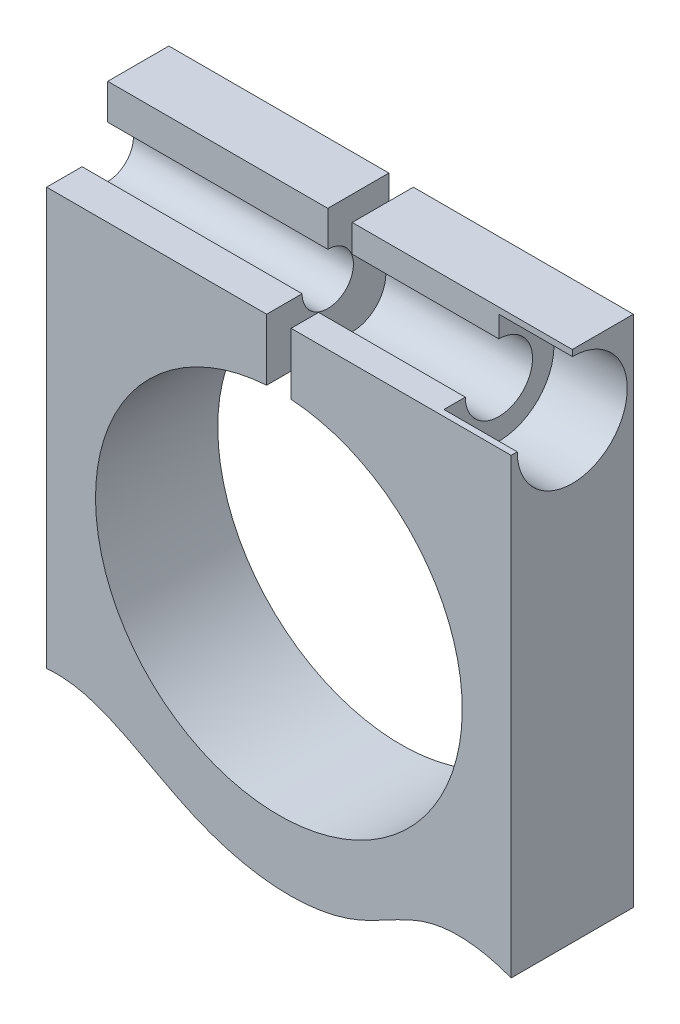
SolidWorks part; units mm, degrees
ref_plane "Plan de face" through (0, 0, 0) normal (0, 0, 1) x (1, 0, 0)
ref_plane "Plan de dessus" through (0, 0, 0) normal (0, 1, 0) x (1, 0, 0)
ref_plane "Plan de droite" through (0, 0, 0) normal (1, 0, 0) x (0, 0, -1)
sketch "Esquisse1" plane through (0, 0, 0) normal (0, 0, 1) x (1, 0, 0)
  line L0 (1, 25) -> (19, 25)
  line L1 (-19, 25) -> (-1, 25)
  line L2 (-19, 25) -> (-19, -45)
  line L3 (-19, -45) -> (19, -45)
  line L4 (19, 25) -> (19, -45)
  line L6 (-1, 25) -> (-1, 14.9666)
  line L8 (1, 25) -> (1, 14.9666)
  arc A0 (-1, 14.9666) -> (1, 14.9666) centre (0, 0) ccw
  dimension "D1" = 30
  dimension "D7" = 45
  dimension "D2" = 38
  dimension "D3" = 1
  dimension "D4" = 1
  dimension "D5" = 19
  dimension "D6" = 25
extrude "Extrusion1" add sketch "Esquisse1" along normal blind 10
hole_wizard "Trou taraudé M51" positions "Esquisse3" profile "Esquisse2" tap size "M5" standard "ISO"
sketch "Esquisse3" plane through (-1, 0, 0) normal (1, 0, 0) x (0, 0, -1)
  line L0 (0, -45) -> (0, 25) construction
  line L1 (-10, 25) -> (0, 25) construction
  point P0 (-5, 20)
  dimension "D1" = 5
  dimension "D2" = 5
sketch "Esquisse2" plane through (-1, 20, 5) normal (0, 1, 0) x (0, 0, -1)
  line L0 (0, 0) -> (0, 18)
  line L1 (0, 18) -> (2.1, 18)
  line L2 (2.1, 18) -> (2.1, 0)
  line L5 (2.1, 0) -> (0, 0)
  line L11 (0, -6.35) -> (0, 107.95) construction
  dimension "Diamètre du trou pour taraudage jusqu'au prochain" = 4.2
  dimension "Profondeur du trou pour taraudage jusqu'au prochain" = 18
sketch "Esquisse6" plane through (19, 0, 0) normal (1, 0, 0) x (0, 0, -1)
  circle A0 centre (-5, 20) radius 4.5
  dimension "D1" = 9
extrude "Enlèv. mat.-Extru.1" cut sketch "Esquisse6" against normal blind 6
sketch "Esquisse7" plane through (13, 0, 0) normal (1, 0, 0) x (0, 0, -1)
  circle A0 centre (-5, 20) radius 2.75
  dimension "D1" = 5.5
extrude "Enlèv. mat.-Extru.2" cut sketch "Esquisse7" against normal blind 12
sketch "Esquisse10" plane through (19, 0, 0) normal (1, 0, 0) x (0, 0, -1)
  line L1 (-10, 25) -> (-5, 25)
  line L2 (-10, 25) -> (-10, 20)
  line L3 (-10, 20) -> (-5, 20)
  line L4 (-5, 25) -> (-5, 20)
extrude "Enlèv. mat.-Extru.3" cut sketch "Esquisse10" against normal blind 45
sketch "Esquisse12" plane through (0, 0, 10) normal (0, 0, 1) x (1, 0, 0)
  spline S0 degree 3 poles (-54.2973, -49.0451) (-34.9703, -22.7777) (-18.57, -10.7386) (-6.3334, -20.1158) (4.8357, -21.0267) (13.3896, -14.714) (31.6084, -20.725) (27.0023, -58.7449) (-10.0049, -62.0691) (-54.2973, -49.0451) (-34.9703, -22.7777) (-18.57, -10.7386) knots -0.517709 -0.324616 -0.1265 0 0.096881 0.156812 0.226225 0.261075 0.320423 0.482291 0.675384 0.8735 1 1.096881 1.156812 1.226225 only from (-32.7501, -22.3521) to (-32.7501, -22.3521)
extrude "Enlèv. mat.-Extru.4" cut sketch "Esquisse12" against normal blind 10
